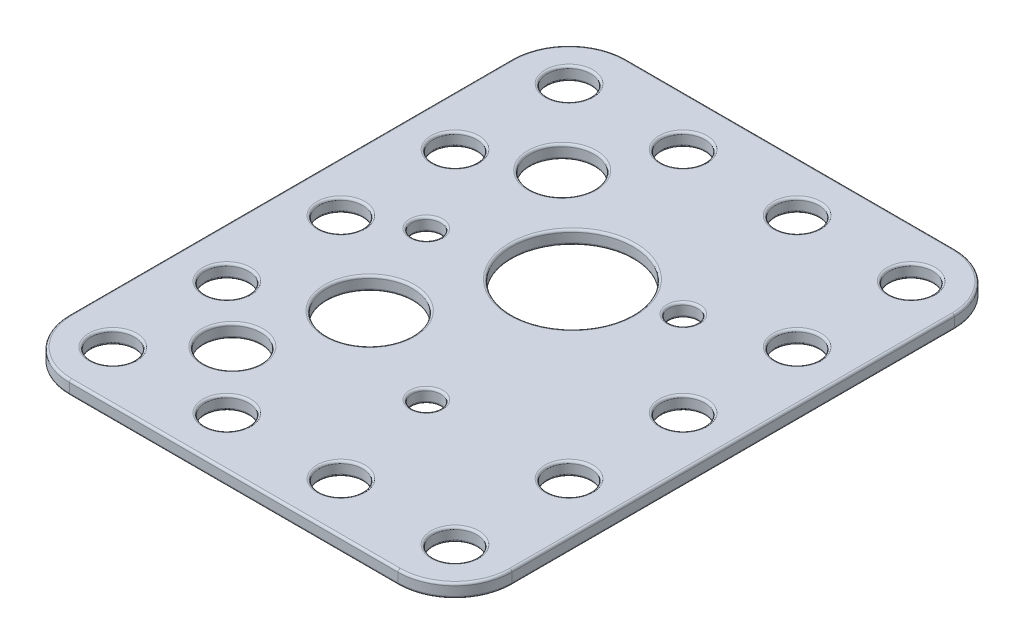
SolidWorks part; units mm, degrees
ref_plane "Front" through (0, 0, 0) normal (0, 0, 1) x (1, 0, 0)
ref_plane "Top" through (0, 0, 0) normal (0, 1, 0) x (1, 0, 0)
ref_plane "Right" through (0, 0, 0) normal (1, 0, 0) x (0, 0, -1)
sketch "Sketch1" plane through (0, 0, 0) normal (0, 1, 0) x (1, 0, 0)
  line L1 (6.35, 0) -> (42.926, 0)
  line L2 (0, 6.35) -> (0, 55.626)
  line L3 (6.35, 61.976) -> (42.926, 61.976)
  line L4 (49.276, 6.35) -> (49.276, 55.626)
  arc A0 (0, 55.626) -> (6.35, 61.976) centre (6.35, 55.626) cw
  arc A1 (42.926, 61.976) -> (49.276, 55.626) centre (42.926, 55.626) cw
  arc A2 (42.926, 0) -> (49.276, 6.35) centre (42.926, 6.35) ccw
  arc A3 (6.35, 0) -> (0, 6.35) centre (6.35, 6.35) cw
  circle A4 centre (13.5636, 47.6504) radius 3.5687
  circle A5 centre (16.383, 23.3934) radius 4.7625
  circle A6 centre (12.192, 12.2936) radius 3.175
  circle A7 centre (24.638, 37.719) radius 6.7564
  point P6 (0, 61.976)
  point P9 (49.276, 61.976)
  point P14 (0, 0)
  dimension "D3" = 6.35
  dimension "D6" = 7.1374
  dimension "D9" = 9.525
  dimension "D12" = 6.35
  dimension "D15" = 13.5128
  dimension "D1" = 49.276
  dimension "D2" = 61.976
  dimension "D4" = 14.3256
  dimension "D5" = 13.5636
  dimension "D7" = 38.5826
  dimension "D8" = 16.383
  dimension "D10" = 49.6824
  dimension "D11" = 12.192
  dimension "D13" = 24.257
  dimension "D14" = 24.638
extrude "Extrude1" add sketch "Sketch1" along normal blind 1.524
sketch "Sketch2" plane through (0, 1.524, 0) normal (0, 1, 0) x (-1, 0, 0)
  line L0 (0, -55.626) -> (0, -6.35) construction
  line L1 (-42.926, -61.976) -> (-6.35, -61.976) construction
  circle A0 centre (-5.588, -56.388) radius 2.413
  dimension "D2" = 4.826
  dimension "D1" = 5.588
  dimension "D3" = 5.588
extrude "Cut-Extrude1" cut sketch "Sketch2" against normal through all
pattern_linear "LPattern1" count 4 spacing 12.7 along (1, 0, 0) of "Cut-Extrude1"
pattern_linear "LPattern2" count 5 spacing 12.7 along (0, 0, 1) of "Cut-Extrude1"
sketch "Sketch3" plane through (0, 1.524, 0) normal (0, 1, 0) x (-1, 0, 0)
  line L0 (-49.276, -6.35) -> (-49.276, -55.626) construction
  line L1 (-6.35, 0) -> (-42.926, 0) construction
  circle A0 centre (-43.688, -5.588) radius 2.413
  circle A1 centre (-5.588, -56.388) radius 2.413 construction
  dimension "D1" = 5.588
  dimension "D2" = 5.588
extrude "Cut-Extrude2" cut sketch "Sketch3" against normal through all
pattern_linear "LPattern3" count 4 spacing 12.7 along (0, 0, -1) of "Cut-Extrude2"
pattern_linear "LPattern4" count 3 spacing 12.7 along (-1, 0, 0) of "Cut-Extrude2"
ref_plane "Plane1" through (24.638, 0, 0) normal (1, 0, 0) x (0, 0, -1)
sketch "Sketch4" plane through (24.638, 0, 0) normal (1, 0, 0) x (0, 0, -1)
  line L0 (30.988, 6.2012) -> (30.988, -3.1411) construction
  line L1 (61.976, 1.524) -> (61.976, 0) construction
  dimension "D1" = 30.988
sketch "Sketch5" plane through (0, 1.524, 0) normal (0, 1, 0) x (-1, 0, 0)
  line L0 (-28.1288, -17.9602) -> (-24.638, -30.988) construction
  line L1 (-24.638, 1.2573) -> (-24.638, -1.2573) construction
  line L2 (-11.6102, -34.4788) -> (-24.638, -30.988) construction
  line L3 (-34.175, -40.525) -> (-24.638, -30.988) construction
  circle A0 centre (-28.1288, -17.9602) radius 1.5875
  circle A1 centre (-34.175, -40.525) radius 1.5875
  circle A2 centre (-11.6102, -34.4788) radius 1.5875
  dimension "D1" = 3.175
  dimension "D2" = 13.4874
  dimension "D3" = 15
  dimension "D4" = 120
  dimension "D5" = 120
extrude "Cut-Extrude3" cut sketch "Sketch5" against normal through all
fillet "Fillet1" radius 0.254 58 edges at (1.8599, 1.524, -1.8599) (34.175, 0, -38.9375) (34.175, 1.524, -38.9375) (11.6102, 0, -32.8913) (11.6102, 1.524, -32.8913) (24.638, 1.524, 0) (47.4161, 1.524, -1.8599) (49.276, 1.524, -30.988) (13.5636, 0, -44.0817) (13.5636, 1.524, -44.0817) (47.4161, 1.524, -60.1161) (16.383, 0, -18.6309) (16.383, 1.524, -18.6309) (24.638, 1.524, -61.976) (12.192, 0, -9.1186) (12.192, 1.524, -9.1186) (24.638, 0, -30.9626) (24.638, 1.524, -30.9626) (1.8599, 1.524, -60.1161) (5.588, 0, -53.975) (5.588, 1.524, -53.975) (18.288, 0, -53.975) (18.288, 1.524, -53.975) (30.988, 0, -53.975) (30.988, 1.524, -53.975) (43.688, 0, -53.975) (43.688, 1.524, -53.975) (5.588, 0, -41.275) (5.588, 1.524, -41.275) (5.588, 0, -28.575) (5.588, 1.524, -28.575) (5.588, 0, -15.875) (5.588, 1.524, -15.875) (24.638, 0, -61.976) (5.588, 0, -3.175) (5.588, 1.524, -3.175) (0, 1.524, -30.988) (47.4161, 0, -60.1161) (43.688, 0, -3.175) (43.688, 1.524, -3.175) (49.276, 0, -30.988) (43.688, 1.524, -15.875) (43.688, 0, -15.875) (47.4161, 0, -1.8599) (43.688, 0, -28.575) (43.688, 1.524, -28.575) (43.688, 0, -41.275) (43.688, 1.524, -41.275) (24.638, 0, 0) (30.988, 1.524, -3.175) (30.988, 0, -3.175) (1.8599, 0, -1.8599) (18.288, 0, -3.175) (18.288, 1.524, -3.175) (0, 0, -30.988) (28.1288, 0, -16.3727) (28.1288, 1.524, -16.3727) (1.8599, 0, -60.1161)
